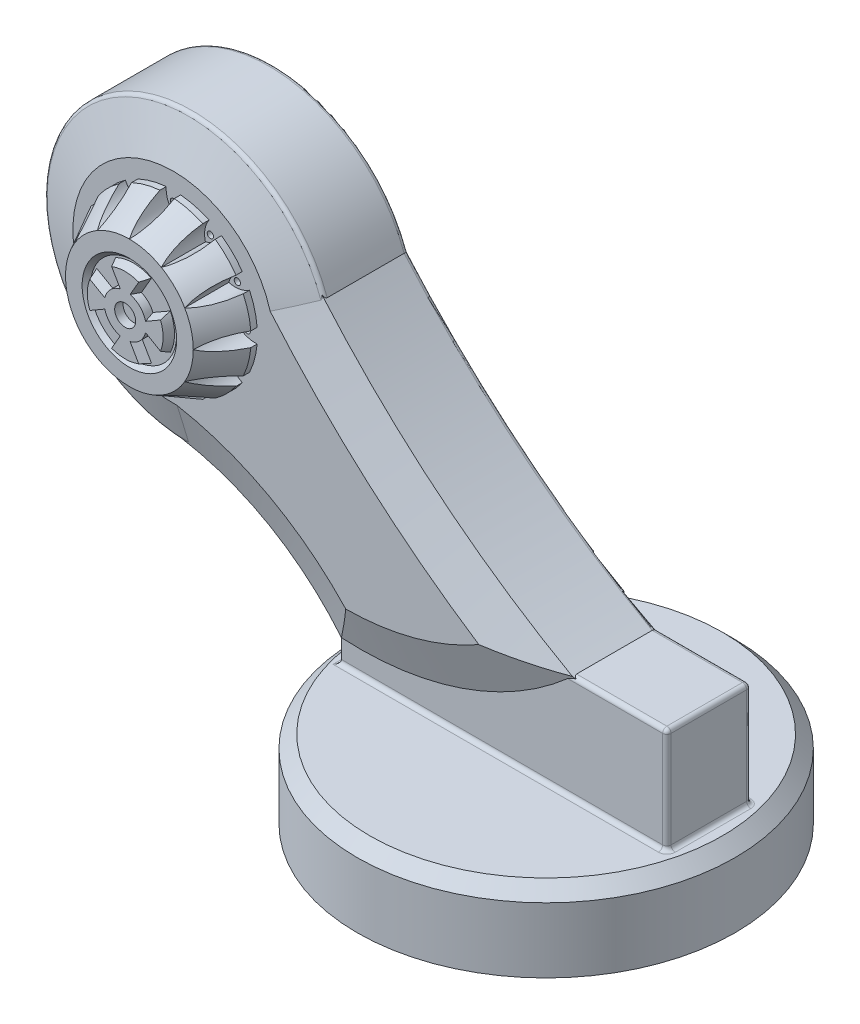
SolidWorks part; units mm, degrees
ref_plane "Front Plane" through (0, 0, 0) normal (0, 0, 1) x (1, 0, 0)
ref_plane "Top Plane" through (0, 0, 0) normal (0, 1, 0) x (1, 0, 0)
ref_plane "Right Plane" through (0, 0, 0) normal (1, 0, 0) x (0, 0, -1)
sketch "Sketch1" plane through (0, 0, 0) normal (0, 1, 0) x (1, 0, 0)
  circle A0 centre (0, 0) radius 90
  dimension "D1" = 180
extrude "Boss-Extrude1" add sketch "Sketch1" along normal blind 37
chamfer "Chamfer1" distance 6 angle 45 1 edges at (0, 37, 90)
sketch "Sketch2" plane through (0, 37, 0) normal (0, 1, 0) x (1, 0, 0)
  line L1 (-77.5, -20) -> (77.5, -20)
  line L2 (-77.5, -20) -> (-77.5, 20)
  line L3 (-77.5, 20) -> (77.5, 20)
  line L4 (77.5, -20) -> (77.5, 20)
  line L5 (-77.5, -20) -> (77.5, 20) construction
  line L6 (-77.5, 20) -> (77.5, -20) construction
  point P0 (0, 0)
  dimension "D1" = 155
  dimension "D2" = 40
extrude "Boss-Extrude2" add sketch "Sketch2" along normal blind 50
sketch "Sketch3" plane through (0, 0, 20) normal (0, 0, 1) x (1, 0, 0)
  line L0 (-77.5, 87) -> (-77.5, 48)
  line L1 (-77.5, 87) -> (-77.5, 37) construction
  line L2 (-77.5, 87) -> (32.5, 87)
  line L3 (-77.5, 87) -> (77.5, 87) construction
  arc A0 (-77.5, 48) -> (32.5, 87) centre (-68.6761, 197.7402) ccw
  dimension "D3" = 150
  dimension "D1" = 39
  dimension "D2" = 110
extrude "Cut-Extrude1" cut sketch "Sketch3" against normal blind 50 contours A0 L2 L0
sketch "Sketch4" plane through (0, 0, 0) normal (0, 0, 1) x (1, 0, 0)
  arc A0 (-85.6406, 183.4547) -> (-150, 91.5) centre (-150, 160) ccw
  arc A1 (-150, 91.5) -> (-77.5, 48) centre (-174.2724, -31.1207) cw
  arc A2 (32.5, 87) -> (-85.6406, 183.4547) centre (247.4874, 470.9016) cw
  arc A3 (-77.5, 48) -> (32.5, 87) centre (-68.6761, 197.7402) ccw construction
  arc A4 (-77.5, 48) -> (32.5, 87) centre (-68.6761, 197.7402) ccw
  dimension "D3" = 137
  dimension "D4" = 440
  dimension "D5" = 125
  dimension "D1" = 150
  dimension "D2" = 160
extrude "Boss-Extrude4" add sketch "Sketch4" along normal mid plane 40 separate body
sketch "Sketch6" plane through (0, 0, 20) normal (0, 0, 1) x (1, 0, 0)
  arc A4 (-77.5, 48) -> (-150, 91.5) centre (-174.2724, -31.1207) ccw
  arc A5 (-77.5, 48) -> (32.5, 87) centre (-68.6761, 197.7402) ccw
  arc A6 (-85.6406, 183.4547) -> (32.5, 87) centre (247.4874, 470.9016) ccw
  arc A7 (-85.6406, 183.4547) -> (-150, 91.5) centre (-150, 160) ccw
  arc A8 (-77.5, 48) -> (-150, 91.5) centre (-174.2724, -31.1207) ccw
  arc A9 (-77.5, 48) -> (32.5, 87) centre (-68.6761, 197.7402) ccw
  arc A10 (-85.6406, 183.4547) -> (32.5, 87) centre (247.4874, 470.9016) ccw
  arc A11 (-85.6406, 183.4547) -> (-150, 91.5) centre (-150, 160) ccw
  dimension "D1" = 0
extrude "Boss-Extrude6" add sketch "Sketch6" along normal blind 7.5 draft 70
sketch "Sketch10" plane through (0, 0, 27.5) normal (0, 0, 1) x (1, 0, 0)
  circle A0 centre (-150, 160) radius 40
  dimension "D1" = 80
extrude "Boss-Extrude7" add sketch "Sketch10" along normal blind 3
sketch "Sketch11" plane through (0, 0, 30.5) normal (0, 0, 1) x (1, 0, 0)
  circle A1 centre (-150, 160) radius 40
  circle A2 centre (-150, 160) radius 40
  dimension "D1" = 0
extrude "Boss-Extrude8" add sketch "Sketch11" along normal blind 18 draft 28
sketch "Sketch14" plane through (0, 0, 48.5) normal (0, 0, 1) x (1, 0, 0)
  line L0 (-150, 190.4292) -> (-150, 200) construction
  circle A0 centre (-150, 160) radius 40 construction
  arc A1 (-146.5574, 199.8516) -> (-153.4426, 199.8516) centre (-150, 160) ccw
  circle A2 centre (-150, 160) radius 30.4292 construction
  arc A4 (-150, 190.4292) -> (-146.5574, 199.8516) centre (-158.5182, 198.8815) ccw
  arc A5 (-150, 190.4292) -> (-153.4426, 199.8516) centre (-141.4818, 198.8815) cw
  circle A6 centre (-150, 160) radius 40 construction
  dimension "D1" = 12
extrude "Cut-Extrude2" cut sketch "Sketch14" against normal up to surface (21 mm away)
sketch "Sketch16" plane through (0, 0, 27.5) normal (0, 0, 1) x (1, 0, 0)
  line L0 (-153.4426, 199.8516) -> (-146.5574, 199.8516) construction
  line L1 (-150, 199.8516) -> (-150, 190.4292) construction
  arc A0 (-153.4426, 199.8516) -> (-146.5574, 199.8516) centre (-150, 160) ccw construction
  arc A1 (-150, 190.4292) -> (-146.5574, 199.8516) centre (-158.5182, 198.8815) ccw construction
  circle A2 centre (-150, 195.1404) radius 1.5
  dimension "D1" = 3
extrude "Cut-Extrude3" cut sketch "Sketch16" against normal blind 5
pattern_circular "CirPattern4" count 12 over 360 about axis through (-150, 160, 0) along (0, 0, 1) of "Cut-Extrude2", "Cut-Extrude3"
sketch "Sketch17" plane through (0, 0, 48.5) normal (0, 0, 1) x (1, 0, 0)
  circle A0 centre (-150, 160) radius 22.5
  dimension "D1" = 45
extrude "Cut-Extrude4" cut sketch "Sketch17" against normal blind 2 draft 45
sketch "Sketch18" plane through (0, 0, 46.5) normal (0, 0, 1) x (1, 0, 0)
  line L0 (-150, 160) -> (-150, 239.3701) construction
  line L1 (-153, 167.953) -> (-158.5319, 177.5345)
  line L2 (-147, 167.953) -> (-141.4681, 177.5345)
  arc A0 (-141.4681, 177.5345) -> (-158.5319, 177.5345) centre (-150, 160) ccw
  arc A1 (-147, 167.953) -> (-153, 167.953) centre (-150, 160) ccw
  dimension "D1" = 17
  dimension "D2" = 39
  dimension "D3" = 30
  dimension "D4" = 3
extrude "Boss-Extrude10" add sketch "Sketch18" along normal blind 4 draft 20 contours A0 L1 A1 L2
pattern_circular "CirPattern5" count 4 over 360 about axis through (-150, 160, 0) along (0, 0, 1) of "Boss-Extrude10"
sketch "Sketch19" plane through (0, 0, 46.5) normal (0, 0, 1) x (1, 0, 0)
  circle A0 centre (-150, 160) radius 9.9559
extrude "Boss-Extrude11" add sketch "Sketch19" along normal up to surface (4 mm away)
sketch "Sketch20" plane through (0, 0, 50.5) normal (0, 0, 1) x (1, 0, 0)
  circle A0 centre (-150, 160) radius 5
extrude "Cut-Extrude5" cut sketch "Sketch20" against normal up to surface (4 mm away)
sketch "Sketch21" plane through (0, 0, -20) normal (0, 0, -1) x (-1, 0, 0)
  circle A0 centre (150, 160) radius 15
  dimension "D1" = 30
extrude "Cut-Extrude6" cut sketch "Sketch21" against normal blind 20
sketch "Sketch22" plane through (0, 0, 0) normal (0, -1, 0) x (1, 0, 0)
  circle A0 centre (0, 0) radius 15
extrude "Cut-Extrude7" cut sketch "Sketch22" against normal blind 20
fillet "Fillet6" radius 2 13 edges at (77.5, 62, 20) (77.5, 87, 0) (55, 87, 20) (-206.12, 199.2785, 20) (-206.12, 199.2785, -20) (-109.9605, 76.0659, -20) (-30.7814, 130.0695, -20) (77.5, 62, -20) (55, 87, -20) (-77.5, 37, 0) (0, 37, 20) (77.5, 37, 0) (0, 37, -20)
sketch "Sketch23" plane through (0, 0, 0) normal (0, 0, 1) x (1, 0, 0)
  line L0 (-150, 160) -> (-150, 0)
  line L1 (-150, 0) -> (0, 0)
  dimension "D1" = 160
